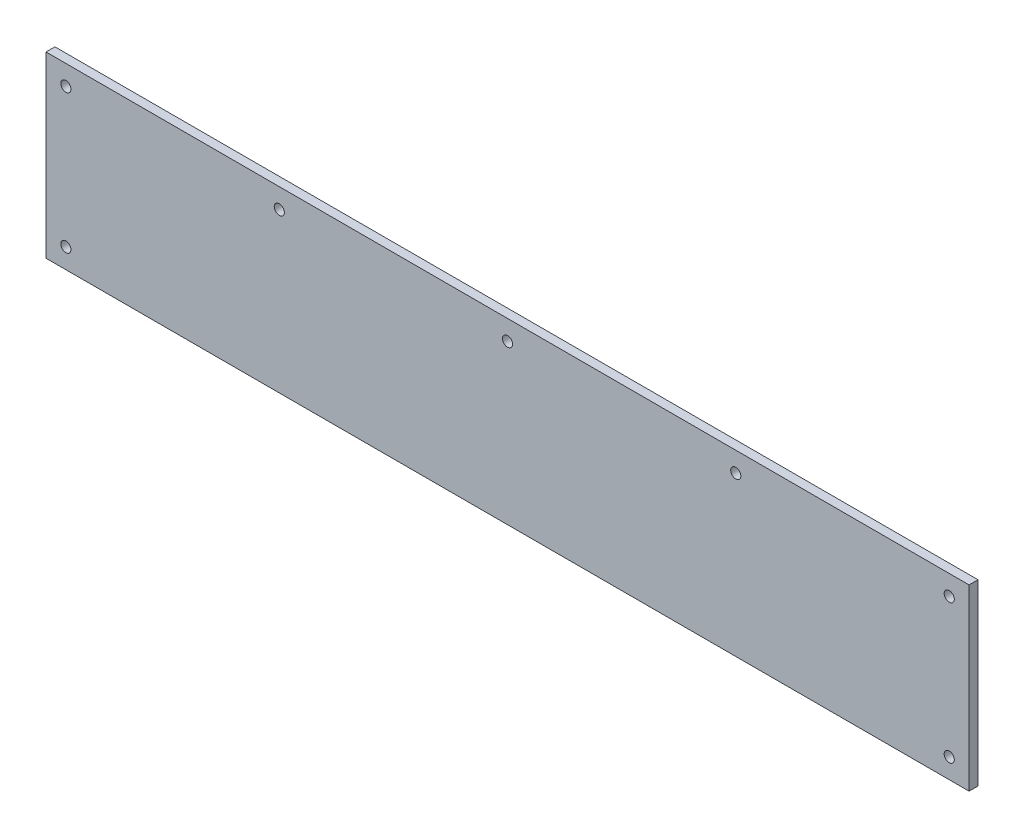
SolidWorks part; units mm, degrees
ref_plane "Front Plane" through (0, 0, 0) normal (0, 0, 1) x (1, 0, 0)
ref_plane "Top Plane" through (0, 0, 0) normal (0, 1, 0) x (1, 0, 0)
ref_plane "Right Plane" through (0, 0, 0) normal (1, 0, 0) x (0, 0, -1)
sketch "Sketch1" plane through (0, 0, 0) normal (0, 0, 1) x (1, 0, 0)
  line L0 (-222.5, 45) -> (-222.5, -45) construction
  line L1 (-232.5, -45) -> (232.5, -45)
  line L2 (-232.5, -45) -> (-232.5, 45)
  line L3 (-232.5, 45) -> (232.5, 45)
  line L4 (232.5, -45) -> (232.5, 45)
  line L5 (-232.5, -45) -> (232.5, 45) construction
  line L6 (-232.5, 45) -> (232.5, -45) construction
  line L7 (0, 45) -> (0, -45) construction
  line L8 (-232.5, 35) -> (2.55, 35) construction
  circle A0 centre (-222.5, 35) radius 2.55
  circle A1 centre (-222.5, -35) radius 2.55
  circle A2 centre (0, 35) radius 2.55
  circle A3 centre (-114.975, 35) radius 2.55
  circle A4 centre (222.5, -35) radius 2.55
  circle A5 centre (222.5, 35) radius 2.55
  circle A6 centre (114.975, 35) radius 2.55
  point P0 (0, 0)
  point P17 (-114.975, 35)
  dimension "D4" = 5.1
  dimension "D5" = 10
  dimension "D6" = 10
  dimension "D7" = 10
  dimension "D1" = 465
  dimension "D2" = 90
  dimension "D3" = 10
extrude "Boss-Extrude1" add sketch "Sketch1" along normal mid plane 4.4958
